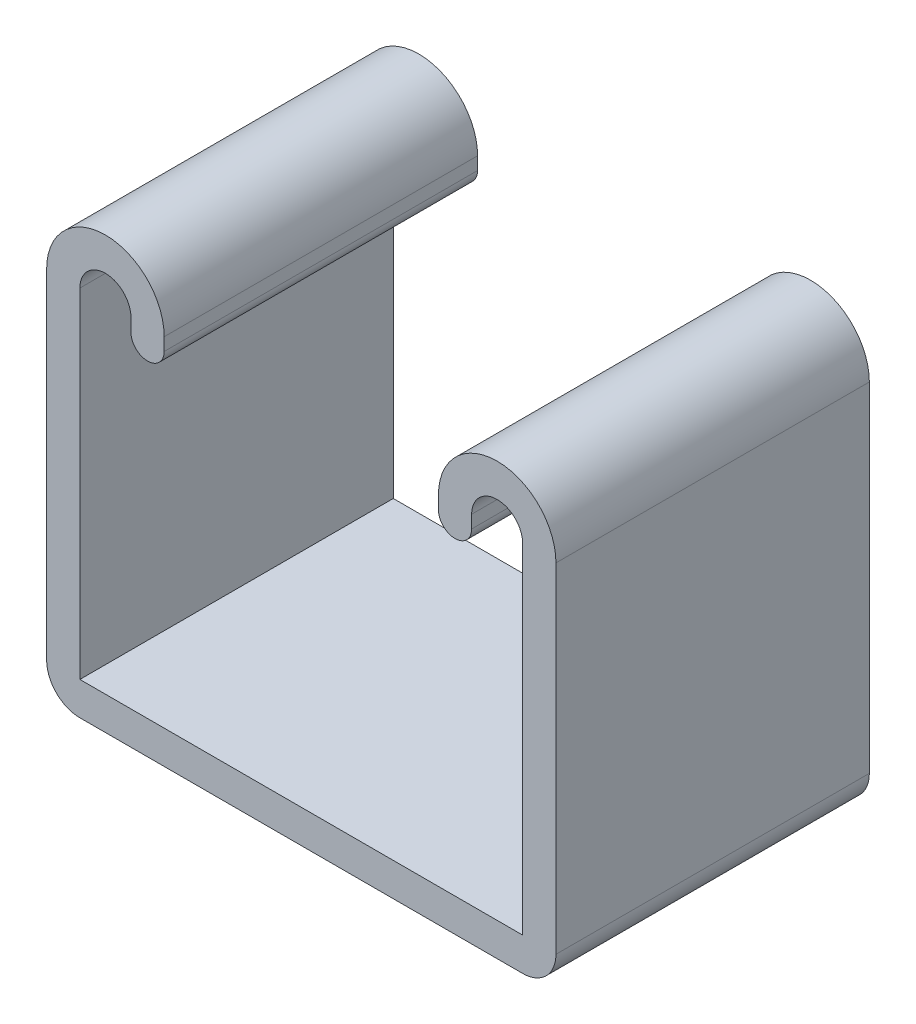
SolidWorks part; units mm, degrees
ref_plane "Plane1" through (0, 0, 0) normal (0, 0, 1) x (1, 0, 0)
ref_plane "Plane2" through (0, 0, 0) normal (0, 1, 0) x (1, 0, 0)
ref_plane "Plane3" through (0, 0, 0) normal (1, 0, 0) x (0, 0, -1)
sketch "Sketch1" plane through (0, 0, 0) normal (0, 0, 1) x (1, 0, 0)
  line L0 (-20.6375, 15.1511) -> (-20.6375, -12.319)
  line L1 (-17.9451, -15.0114) -> (17.9451, -15.0114)
  line L2 (20.6375, -12.319) -> (20.6375, 15.1511)
  line L3 (11.1125, 15.1511) -> (11.1125, 14.116)
  line L4 (-11.1125, 15.1511) -> (-11.1125, 14.116)
  line L5 (-13.8049, 15.1511) -> (-13.8049, 14.116)
  line L6 (-17.9451, 15.1511) -> (-17.9451, -12.319)
  line L7 (-17.9451, -12.319) -> (17.9451, -12.319)
  line L8 (17.9451, -12.319) -> (17.9451, 15.1511)
  line L9 (13.8049, 15.1511) -> (13.8049, 14.116)
  line L10 (-25.4, 19.9136) -> (25.4, 19.9136) construction
  line L11 (-12.8524, 12.7698) -> (12.8524, 12.7698) construction
  arc A0 (20.6375, 15.1511) -> (11.1125, 15.1511) centre (15.875, 15.1511) ccw
  arc A1 (-20.6375, 15.1511) -> (-11.1125, 15.1511) centre (-15.875, 15.1511) cw
  arc A2 (-17.9451, -15.0114) -> (-20.6375, -12.319) centre (-17.9451, -12.319) cw
  arc A3 (17.9451, -15.0114) -> (20.6375, -12.319) centre (17.9451, -12.319) ccw
  arc A4 (-17.9451, 15.1511) -> (-13.8049, 15.1511) centre (-15.875, 15.1511) cw
  arc A5 (17.9451, 15.1511) -> (13.8049, 15.1511) centre (15.875, 15.1511) ccw
  arc A6 (11.1125, 14.116) -> (13.8049, 14.116) centre (12.4587, 14.116) ccw
  arc A7 (-11.1125, 14.116) -> (-13.8049, 14.116) centre (-12.4587, 14.116) cw
  dimension "D1" = 2.6924
  dimension "D3" = 20.6375
  dimension "Width" = 41.275
  dimension "D5" = 15.0114
  dimension "D6" = 9.525
  dimension "D7" = 22.225
  dimension "D8" = 19.9136
  dimension "D9" = 7.1437
  dimension "gauge" = 2.6924
extrude "Base-Extrude" add sketch "Sketch1" along normal mid plane 25.4
equation "\"D3@Sketch1\" = \"Width@Sketch1\" / 2"
equation "\"D7@Sketch1\" = \"Width@Sketch1\" - 2 * \"D6@Sketch1\""
equation "\"D1@Sketch1\" = \"gauge@Sketch1\""
